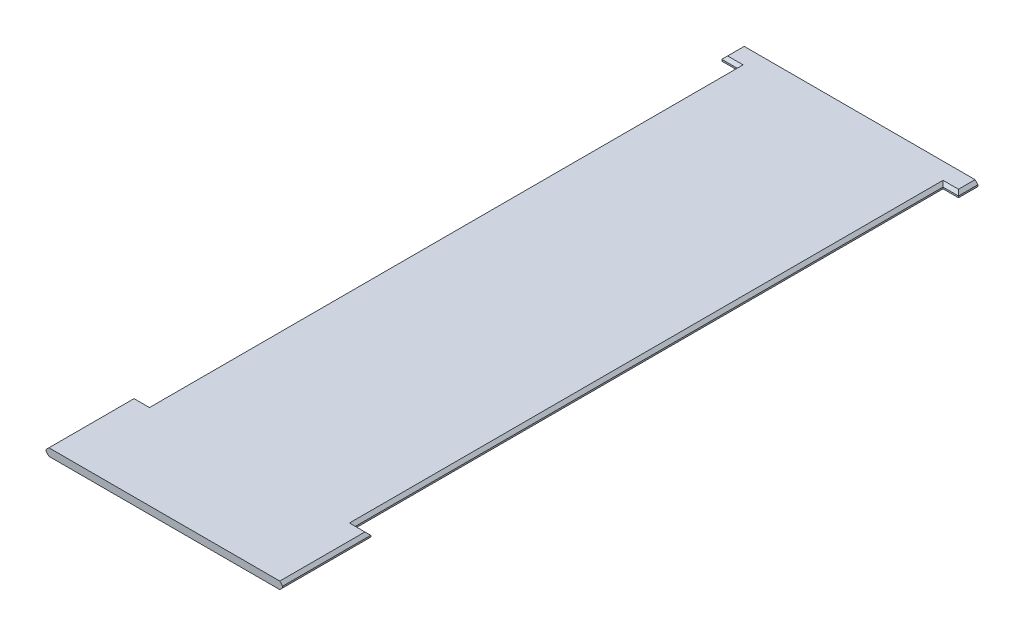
SolidWorks part; units mm, degrees
ref_plane "Front Plane" through (0, 0, 0) normal (1, 0, 0) x (0, 1, 0)
ref_plane "Top Plane" through (0, 0, 0) normal (0, 0, 1) x (0, 1, 0)
ref_plane "Right Plane" through (0, 0, 0) normal (0, 1, 0) x (-1, 0, 0)
sketch "Sketch2"
sketch_block_instance "Block5-1"
sketch_block "Block5"
extrude "Boss-Extrude2" add sketch "Sketch2" along normal mid plane 38.1
chamfer "Chamfer1" distance 15 angle 45 32 edges at (474.0616, 0, -1445.0719) (513.6616, 19.05, -1445.0719) (513.6616, -19.05, -1445.0719) (553.2616, 0, -1445.0719) (553.2616, 19.05, -1495.0719) (553.2616, 0, -1545.0719) (553.2616, -19.05, -1495.0719) (474.0616, 19.05, 60.9281) (474.0616, -19.05, 60.9281) (513.6616, 19.05, 1566.9281) (474.0616, 0, 1566.9281) (513.6616, -19.05, 1566.9281) (553.2616, 0, 2018.1281) (553.2616, 19.05, 1792.5281) (553.2616, 0, 1566.9281) (553.2616, -19.05, 1792.5281) (-659.9384, 0, 1566.9281) (-659.9384, 19.05, 1792.5281) (-659.9384, 0, 2018.1281) (-659.9384, -19.05, 1792.5281) (-620.3384, 19.05, 1566.9281) (-620.3384, -19.05, 1566.9281) (-580.7384, 19.05, 60.9281) (-580.7384, 0, 1566.9281) (-580.7384, -19.05, 60.9281) (-620.3384, 19.05, -1445.0719) (-580.7384, 0, -1445.0719) (-620.3384, -19.05, -1445.0719) (-659.9384, 0, -1545.0719) (-659.9384, 19.05, -1495.0719) (-659.9384, 0, -1445.0719) (-659.9384, -19.05, -1495.0719)
